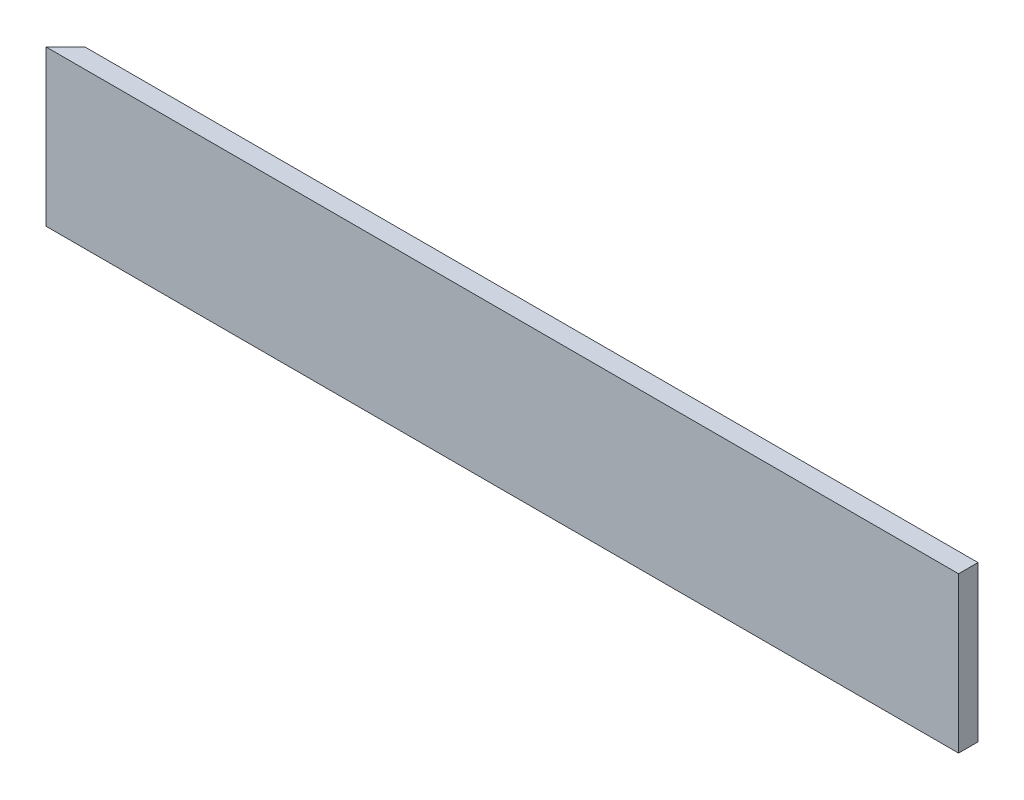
SolidWorks part; units mm, degrees
ref_plane "Front Plane" through (0, 0, 0) normal (0, 0, 1) x (1, 0, 0)
ref_plane "Top Plane" through (0, 0, 0) normal (0, 1, 0) x (1, 0, 0)
ref_plane "Right Plane" through (0, 0, 0) normal (1, 0, 0) x (0, 0, -1)
sketch "Sketch2" plane through (0, 0, 0) normal (0, 1, 0) x (1, 0, 0)
  line L0 (0, 0) -> (0, -25.4)
  line L1 (0, -25.4) -> (-1193.8, -25.4)
  line L2 (-1193.8, -25.4) -> (-1168.4, 0)
  line L3 (-1168.4, 0) -> (0, 0)
extrude "Boss-Extrude1" add sketch "Sketch2" along normal blind 203.2
equation "\"system_width\"= 7ft + 10 "
equation "\"system_length\"= 95.5"
equation "\"module_board_length\"= 11.25in"
equation "\"module_board_width\"= 1.5in"
equation "\"step_board_length\"= 5.5in"
equation "\"step_board_width\"= 1.5in"
equation "\"module_lip_width\"= 1.5in"
equation "\"module_trim_thickness\"= 1in"
equation "\"module_width\"= (\"system_width\" -  2* \"module_trim_thickness\") / 2"
equation "\"module_board_short_depth\"= \"module_width\" - ( 2 * \"module_board_width\" ) - \"module_lip_width\""
equation "\"module_board_hole\"= 0.5in"
equation "\"module_board_hole_seperation\"= 20in"
equation "\"system_step_length\"= 2ft+11.5"
equation "\"system_top_length\"= \"system_length\" - \"system_step_length\""
equation "\"module_top_thickness\"= 0.75in"
equation "\"module_trim_height\"= 14in"
equation "\"module_top_overhang\"= 4.5in"
equation "\"module_trim_angle\"= 45deg"
equation "\"module_length\"= (\"system_top_length\" - \"module_trim_thickness\")/ 2"
equation "\"module_board_long_depth\"= \"module_length\" - \"module_lip_width\""
equation "\"module_board_hole_position\"= ( ( \"module_width\" - \"module_board_hole_seperation\" ) / 2 ) + \"module_board_width\"/2"
equation "\"step_module_width\"= \"module_width\""
equation "\"step_module_length\"= \"system_step_length\" - \"module_trim_thickness\""
equation "\"step_board_short_depth\"= \"step_module_length\" - \"module_lip_width\""
equation "\"step_board_long_depth\"= \"step_module_width\" - (2 * \"module_board_width\") - \"module_lip_width\""
equation "\"D1@Sketch2\"=\"step_module_width\" + \"module_trim_thickness\""
equation "\"D2@Sketch2\"=\"module_trim_thickness\""
equation "\"step_trim_height\"= 8in"
equation "\"D1@Boss-Extrude1\"=\"step_trim_height\""
